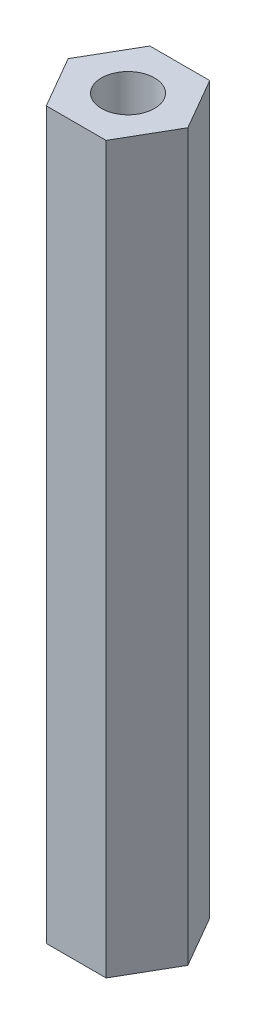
SolidWorks part; units mm, degrees
ref_plane "Front Plane" through (0, 0, 0) normal (0, 0, 1) x (1, 0, 0)
ref_plane "Top Plane" through (0, 0, 0) normal (0, 1, 0) x (1, 0, 0)
ref_plane "Right Plane" through (0, 0, 0) normal (1, 0, 0) x (0, 0, -1)
sketch "Sketch1" plane through (0, 0, 0) normal (0, 1, 0) x (1, 0, 0)
  line L1 (1.8331, 3.175) -> (-1.8331, 3.175)
  line L2 (-1.8331, 3.175) -> (-3.6662, 0)
  line L3 (-3.6662, 0) -> (-1.8331, -3.175)
  line L4 (-1.8331, -3.175) -> (1.8331, -3.175)
  line L5 (1.8331, -3.175) -> (3.6662, 0)
  line L6 (3.6662, 0) -> (1.8331, 3.175)
  circle A0 centre (0, 0) radius 3.175 construction
  circle A1 centre (0, 0) radius 1.6256
  dimension "D2" = 3.2512
  dimension "D1" = 6.35
extrude "Boss-Extrude1" add sketch "Sketch1" along normal blind 44.45
